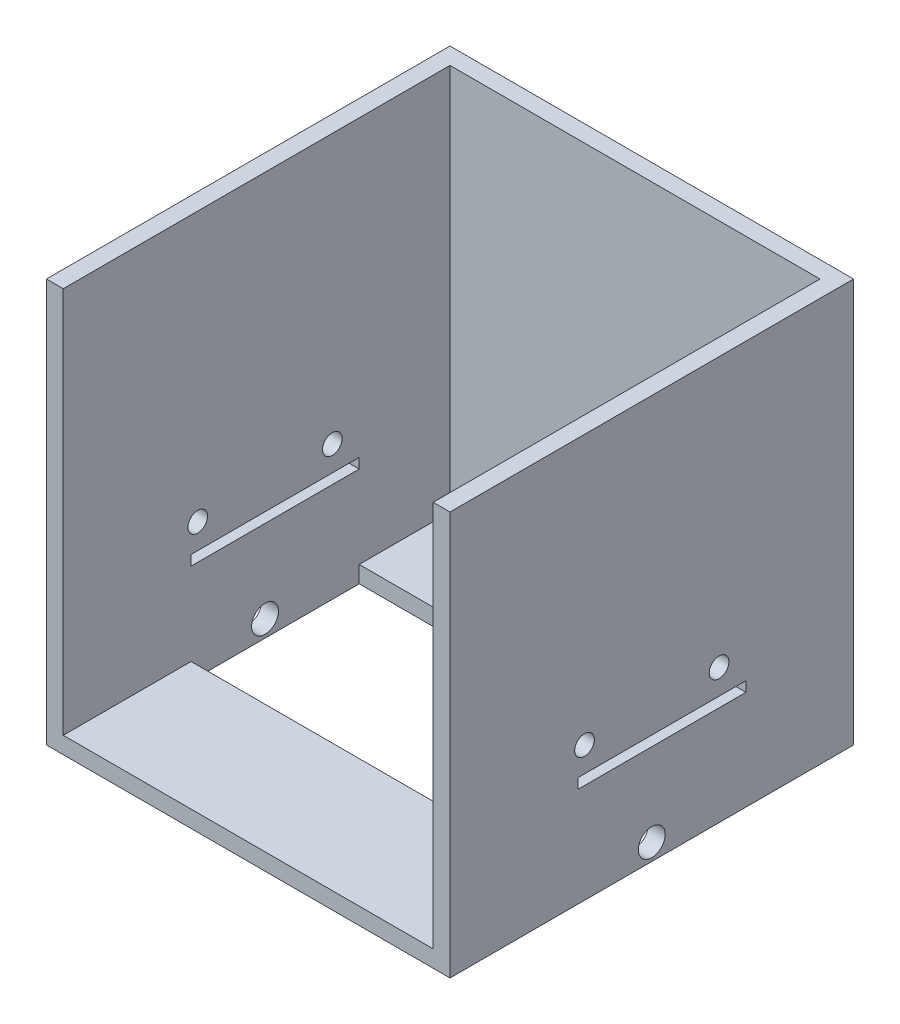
SolidWorks part; units mm, degrees
ref_plane "Front Plane" through (0, 0, 0) normal (0, 0, 1) x (1, 0, 0)
ref_plane "Top Plane" through (0, 0, 0) normal (0, 1, 0) x (1, 0, 0)
ref_plane "Right Plane" through (0, 0, 0) normal (1, 0, 0) x (0, 0, -1)
sketch "Sketch1" plane through (0, 0, 0) normal (0, 1, 0) x (1, 0, 0)
  line L1 (-60, 60) -> (60, 60)
  line L2 (-60, 60) -> (-60, -60)
  line L3 (-60, -60) -> (60, -60)
  line L4 (60, 60) -> (60, -60)
  line L5 (-60, 60) -> (60, -60) construction
  line L6 (-60, -60) -> (60, 60) construction
  point P0 (0, 0)
  dimension "D1" = 120
  dimension "D2" = 120
extrude "body" add sketch "Sketch1" along normal blind 120
sketch "Sketch2" plane through (0, 120, 0) normal (0, 1, 0) x (1, 0, 0)
  line L0 (-60, -60) -> (60, -60) construction
  line L1 (-55, -60) -> (55, -60)
  line L2 (-55, -60) -> (-55, 55)
  line L3 (-55, 55) -> (55, 55)
  line L4 (55, -60) -> (55, 55)
  line L5 (60, -60) -> (60, 60) construction
  line L6 (-60, 60) -> (-60, -60) construction
  line L7 (60, 60) -> (-60, 60) construction
  dimension "D1" = 5
  dimension "D2" = 5
  dimension "D3" = 5
extrude "hollowcube" cut sketch "Sketch2" against normal blind 115
sketch "Sketch8" plane through (-60, 0, 0) normal (-1, 0, 0) x (0, 0, 1)
  line L0 (20, 40) -> (-20, 40) construction
  line L1 (-60, 0) -> (60, 0) construction
  line L2 (-60, 120) -> (-60, 0) construction
  line L3 (-28, 29.56) -> (22, 29.56)
  line L4 (-28, 29.56) -> (-28, 32.56)
  line L5 (-28, 32.56) -> (22, 32.56)
  line L6 (22, 29.56) -> (22, 32.56)
  circle A0 centre (20, 40) radius 2.921
  circle A1 centre (0, 4.9982) radius 4
  circle A2 centre (-20, 40) radius 2.921
  dimension "D3" = 8
  dimension "D1" = 40
  dimension "D2" = 40
  dimension "D4" = 40
extrude "Cut-Extrude3" cut sketch "Sketch8" against normal through all
sketch "Sketch3" plane through (0, 5, 0) normal (0, 1, 0) x (1, 0, 0)
  line L0 (55, -60) -> (55, -4) construction
  line L1 (-55, -60) -> (55, -60)
  line L2 (-55, -60) -> (-55, -55)
  line L3 (-55, -55) -> (55, -55)
  line L4 (55, -60) -> (55, -55)
  dimension "D1" = 5
extrude "front bottom" [suppressed] add sketch "Sketch3" along normal blind 30
sketch "Sketch4" [suppressed] plane through (0, 0, -55) normal (0, 0, 1) x (1, 0, 0)
  line L0 (55, 35) -> (55, 120) construction
  line L1 (-55, 35) -> (55, 35)
  line L2 (-55, 35) -> (-55, 38)
  line L3 (-55, 38) -> (55, 38)
  line L4 (55, 35) -> (55, 38)
  dimension "D1" = 3
extrude "Boss-Extrude3" [suppressed] add sketch "Sketch4" along normal up to surface (95 mm away)
sketch "Sketch6" [suppressed] plane through (0, 0, 60) normal (0, 0, 1) x (1, 0, 0)
  line L0 (0, 0) -> (0, 89.7467) construction
  line L1 (55, 35) -> (57, 35)
  line L2 (55, 35) -> (55, 40)
  line L3 (55, 40) -> (57, 40)
  line L4 (57, 35) -> (57, 40)
  line L5 (-55, 35) -> (-57, 35)
  line L6 (-55, 40) -> (-57, 40)
  line L7 (-55, 35) -> (-55, 40)
  line L8 (-57, 35) -> (-57, 40)
  dimension "D1" = 5
  dimension "D2" = 2
extrude "Cut-Extrude1" [suppressed] cut sketch "Sketch6" against normal up to surface (115 mm away)
sketch "Sketch9" plane through (0, 5, 0) normal (0, 1, 0) x (1, 0, 0)
  line L0 (55, -60) -> (55, 55) construction
  line L1 (-55, 28) -> (55, 28)
  line L2 (-55, 28) -> (-55, -22)
  line L3 (-55, -22) -> (55, -22)
  line L4 (55, 28) -> (55, -22)
  line L5 (-55, 28) -> (55, -22) construction
  line L6 (-55, -22) -> (55, 28) construction
  dimension "D1" = 50
  dimension "D2" = 28
extrude "Cut-Extrude4" cut sketch "Sketch9" against normal blind 10
sketch "Sketch5" plane through (0, 120, 0) normal (0, 1, 0) x (1, 0, 0)
  line L0 (60, -60) -> (60, 60) construction
  line L1 (-60, 60) -> (60, 60)
  line L2 (-60, 60) -> (-60, 30)
  line L3 (-60, 30) -> (60, 30)
  line L4 (60, 60) -> (60, 30)
  dimension "D1" = 30
extrude "head" add sketch "Sketch5" along normal blind 30
equation "\"sheetthickness\"= 3mm"
